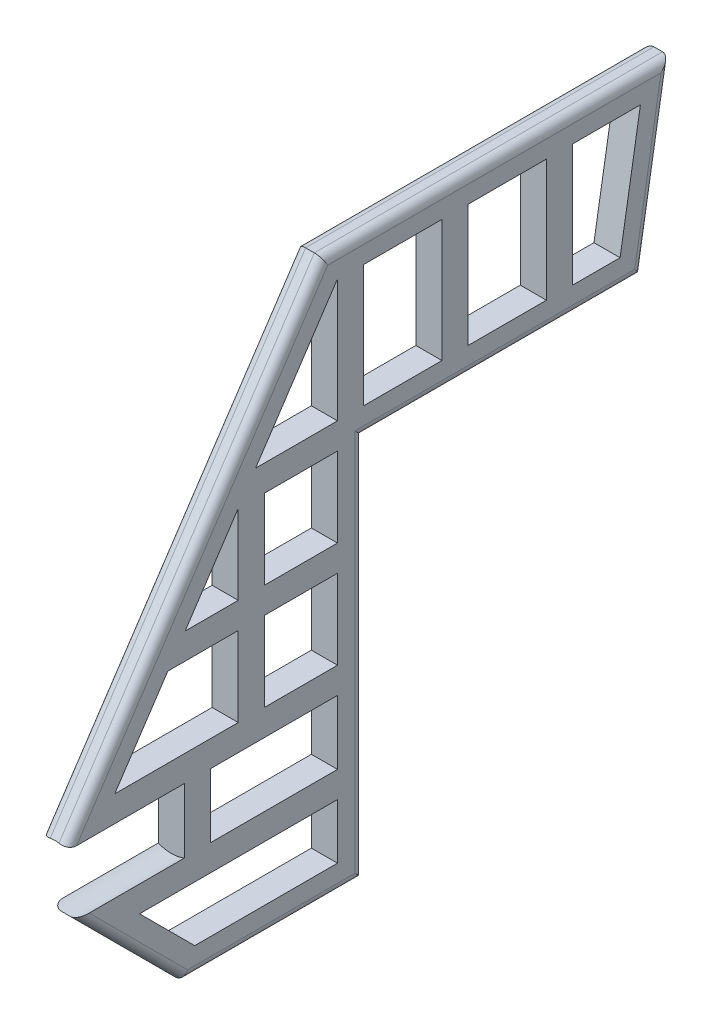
SolidWorks part; units mm, degrees
ref_plane "Front Plane" through (0, 0, 0) normal (0, 0, 1) x (1, 0, 0)
ref_plane "Top Plane" through (0, 0, 0) normal (0, 1, 0) x (1, 0, 0)
ref_plane "Right Plane" through (0, 0, 0) normal (1, 0, 0) x (0, 0, -1)
sketch "Sketch1" plane through (0, 0, 0) normal (1, 0, 0) x (0, 0, -1)
  line L0 (0, 0) -> (-32.766, 0)
  line L1 (-32.766, 0) -> (-52.343, 19.577)
  line L2 (-52.343, 19.577) -> (-32.6779, 19.577)
  line L3 (-32.6779, 19.577) -> (-32.6779, 31.261)
  line L4 (-32.6779, 31.261) -> (-54.2679, 31.261)
  line L5 (-54.2679, 31.261) -> (-7.3981, 101.6693)
  line L6 (-7.3981, 101.6693) -> (56.1019, 101.6693)
  line L7 (56.1019, 101.6693) -> (50.8, 69.85)
  line L8 (50.8, 69.85) -> (0, 69.85)
  line L9 (0, 69.85) -> (0, 0)
  dimension "D1" = 32.766
  dimension "D2" = 27.686
  dimension "D3" = 11.684
  dimension "D4" = 21.59
  dimension "D5" = 45
  dimension "D6" = 84.582
  dimension "D7" = 63.5
  dimension "D8" = 80.54
  dimension "D9" = 32.258
  dimension "D10" = 50.8
  dimension "D11" = 69.85
extrude "Boss-Extrude1" add sketch "Sketch1" along normal blind 4.7625
sketch "Sketch2" plane through (4.7625, 0, 0) normal (1, 0, 0) x (0, 0, -1)
  line L20 (-30.7933, 4.7625) -> (-4.7625, 4.7625)
  line L21 (-40.8453, 14.8145) -> (-30.7933, 4.7625)
  line L22 (-27.9154, 14.8145) -> (-40.8453, 14.8145)
  line L23 (-27.9154, 36.0235) -> (-27.9154, 14.8145)
  line L24 (-45.3764, 36.0235) -> (-27.9154, 36.0235)
  line L25 (-4.8472, 96.9068) -> (-45.3764, 36.0235)
  line L26 (50.4802, 96.9068) -> (-4.8472, 96.9068)
  line L27 (46.7654, 74.6125) -> (50.4802, 96.9068)
  line L28 (-4.7625, 74.6125) -> (46.7654, 74.6125)
  line L29 (-4.7625, 4.7625) -> (-4.7625, 74.6125)
  line L30 (-30.7933, 4.7625) -> (-4.7625, 4.7625)
  line L31 (-40.8453, 14.8145) -> (-30.7933, 4.7625)
  line L32 (-27.9154, 14.8145) -> (-40.8453, 14.8145)
  line L33 (-27.9154, 36.0235) -> (-27.9154, 14.8145)
  line L34 (-45.3764, 36.0235) -> (-27.9154, 36.0235)
  line L35 (-4.8472, 96.9068) -> (-45.3764, 36.0235)
  line L36 (50.4802, 96.9068) -> (-4.8472, 96.9068)
  line L37 (46.7654, 74.6125) -> (50.4802, 96.9068)
  line L38 (-4.7625, 74.6125) -> (46.7654, 74.6125)
  line L39 (-4.7625, 4.7625) -> (-4.7625, 74.6125)
  dimension "D1" = 4.7625
extrude "Cut-Extrude1" cut sketch "Sketch2" against normal through all both and the other way through all
sketch "Sketch3" plane through (0, 0, 32.6779) normal (0, 0, 1) x (1, 0, 0)
  line L0 (0, 25.419) -> (4.7625, 25.419) construction
  line L1 (0, 31.261) -> (0, 19.577) construction
  line L2 (4.7625, 31.261) -> (4.7625, 19.577) construction
  line L3 (2.3813, 31.261) -> (2.3813, 19.577) construction
  line L4 (4.7625, 31.261) -> (0, 31.261) construction
  line L5 (4.7625, 19.577) -> (0, 19.577) construction
  circle A0 centre (2.3812, 25.419) radius 6.35
  dimension "D1" = 12.7
extrude "Cut-Extrude2" cut sketch "Sketch3" along normal through all
sketch "Sketch4" plane through (0, 74.6125, 0) normal (0, 1, 0) x (1, 0, 0)
  line L1 (4.7625, 46.7654) -> (4.7625, -4.7625) construction
  line L2 (0, -4.7625) -> (4.7625, -4.7625)
  line L3 (0, -4.7625) -> (0, 0)
  line L4 (0, 0) -> (4.7625, 0)
  line L5 (4.7625, -4.7625) -> (4.7625, 0)
  line L6 (0, 14.2875) -> (4.7625, 14.2875)
  line L7 (0, 14.2875) -> (0, 19.05)
  line L8 (0, 19.05) -> (4.7625, 19.05)
  line L9 (4.7625, 14.2875) -> (4.7625, 19.05)
  line L10 (0, 33.3375) -> (4.7625, 33.3375)
  line L11 (0, 33.3375) -> (0, 38.1)
  line L12 (0, 38.1) -> (4.7625, 38.1)
  line L13 (4.7625, 33.3375) -> (4.7625, 38.1)
  dimension "D1" = 4.7625
  dimension "D2" = 3
extrude "Boss-Extrude2" add sketch "Sketch4" along normal up to surface (22.2943 mm away)
sketch "Sketch5" plane through (0, 0, 27.9154) normal (0, 0, -1) x (-1, 0, 0)
  line L0 (0, 36.0235) -> (0, 14.8145) construction
  line L1 (-4.7625, 36.0235) -> (0, 36.0235)
  line L2 (-4.7625, 36.0235) -> (-4.7625, 31.261)
  line L3 (-4.7625, 31.261) -> (0, 31.261)
  line L4 (0, 36.0235) -> (0, 31.261)
  line L6 (-4.7625, 14.8145) -> (0, 14.8145)
  line L7 (-4.7625, 14.8145) -> (-4.7625, 19.577)
  line L8 (-4.7625, 19.577) -> (0, 19.577)
  line L9 (0, 14.8145) -> (0, 19.577)
  dimension "D1" = 4.7625
  dimension "D2" = 4.7625
extrude "Boss-Extrude3" add sketch "Sketch5" along normal up to surface (23.1529 mm away)
sketch "Sketch6" plane through (0, 0, 4.7625) normal (0, 0, 1) x (1, 0, 0)
  line L0 (0, 36.0235) -> (0, 96.9068) construction
  line L1 (0, 74.6125) -> (4.7625, 74.6125)
  line L2 (0, 74.6125) -> (0, 69.85)
  line L3 (0, 69.85) -> (4.7625, 69.85)
  line L4 (4.7625, 74.6125) -> (4.7625, 69.85)
  line L5 (4.7625, 96.9068) -> (4.7625, 36.0235) construction
  line L7 (0, 55.318) -> (4.7625, 55.318)
  line L8 (0, 55.318) -> (0, 50.5555)
  line L9 (0, 50.5555) -> (4.7625, 50.5555)
  line L10 (4.7625, 55.318) -> (4.7625, 50.5555)
  line L12 (4.7625, 74.6125) -> (0, 74.6125) construction
  line L13 (0, 52.9367) -> (4.7625, 52.9367) construction
  line L14 (0, 36.0235) -> (4.7625, 36.0235) construction
  dimension "D1" = 4.7625
  dimension "D2" = 4.7625
extrude "Boss-Extrude4" add sketch "Sketch6" along normal up to surface (14.9257 mm away)
sketch "Sketch7" plane through (0, 69.85, 0) normal (0, -1, 0) x (1, 0, 0)
  line L0 (0, 22.8585) -> (0, 4.7625) construction
  line L1 (4.7625, 22.8585) -> (0, 22.8585)
  line L2 (4.7625, 22.8585) -> (4.7625, 18.096)
  line L3 (4.7625, 18.096) -> (0, 18.096)
  line L4 (0, 22.8585) -> (0, 18.096)
  dimension "D1" = 4.7625
extrude "Boss-Extrude5" add sketch "Sketch7" along normal up to surface (33.8265 mm away)
fillet "Fillet1" radius 1.5875 14 edges at (0, 9.7662, 42.5322) (0, 85.7597, -53.4509) (0, 69.85, -25.4) (0, 34.925, 0) (0, 0, 16.383) (0, 66.4874, 30.8182) (0, 101.6693, -24.3519) (4.7625, 9.7662, 42.5322) (4.7625, 0, 16.383) (4.7625, 34.925, 0) (4.7625, 69.85, -25.4) (4.7625, 85.7597, -53.4509) (4.7625, 101.6693, -24.3519) (4.7625, 66.4874, 30.8182)
